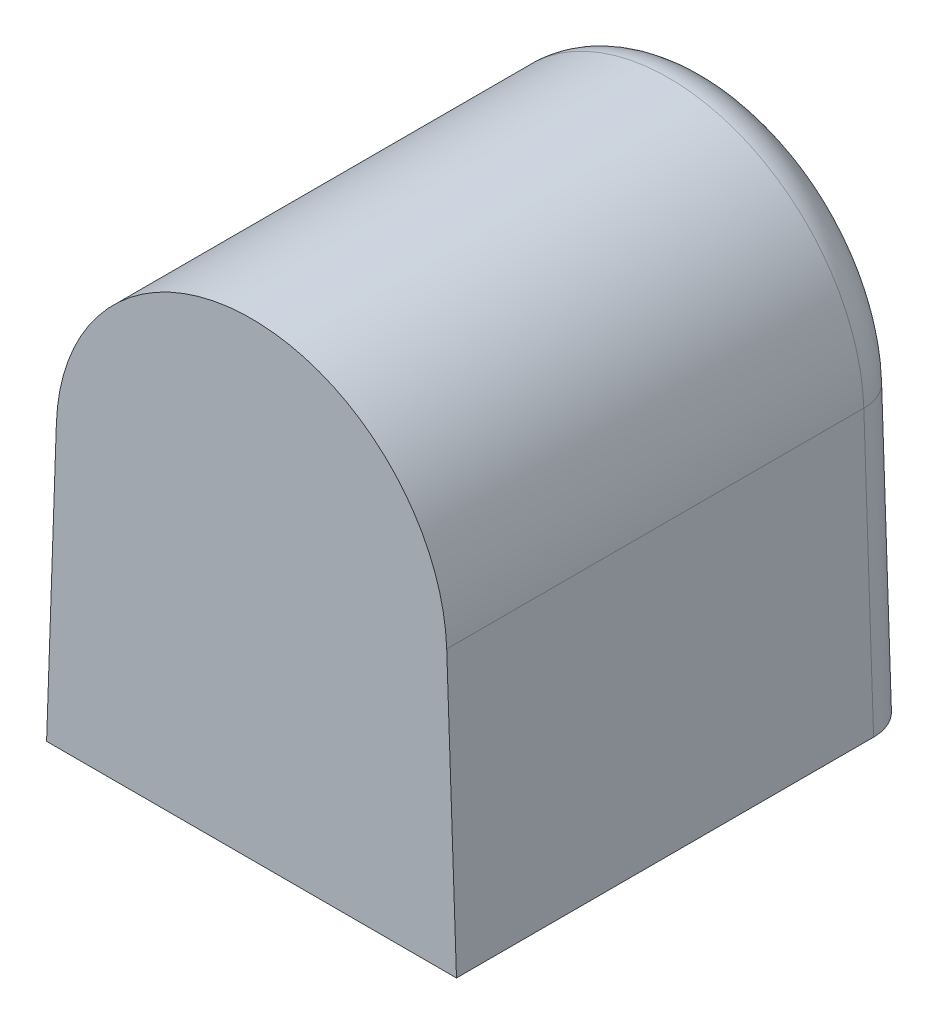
SolidWorks part; units mm, degrees
ref_plane "Front Plane" through (0, 0, 0) normal (0, 0, 1) x (1, 0, 0)
ref_plane "Top Plane" through (0, 0, 0) normal (0, 1, 0) x (1, 0, 0)
ref_plane "Right Plane" through (0, 0, 0) normal (1, 0, 0) x (0, 0, -1)
sketch "Sketch1" plane through (0, 0, 0) normal (0, 0, 1) x (1, 0, 0)
  line L0 (0, 0) -> (0, 19) construction
  line L1 (-14.25, 0) -> (14.25, 0)
  line L2 (14.25, 0) -> (13.57, 19.4739)
  line L3 (-14.25, 0) -> (-13.57, 19.4739)
  arc A0 (-13.57, 19.4739) -> (13.57, 19.4739) centre (0, 19) cw
  dimension "D1" = 19
  dimension "D2" = 2
  dimension "D3" = 28.5
extrude "Boss-Extrude1" add sketch "Sketch1" against normal blind 32
fillet "Fillet1" radius 3 3 edges at (13.91, 9.7369, -32) (-13.91, 9.7369, -32) (0, 32.5782, -32)
